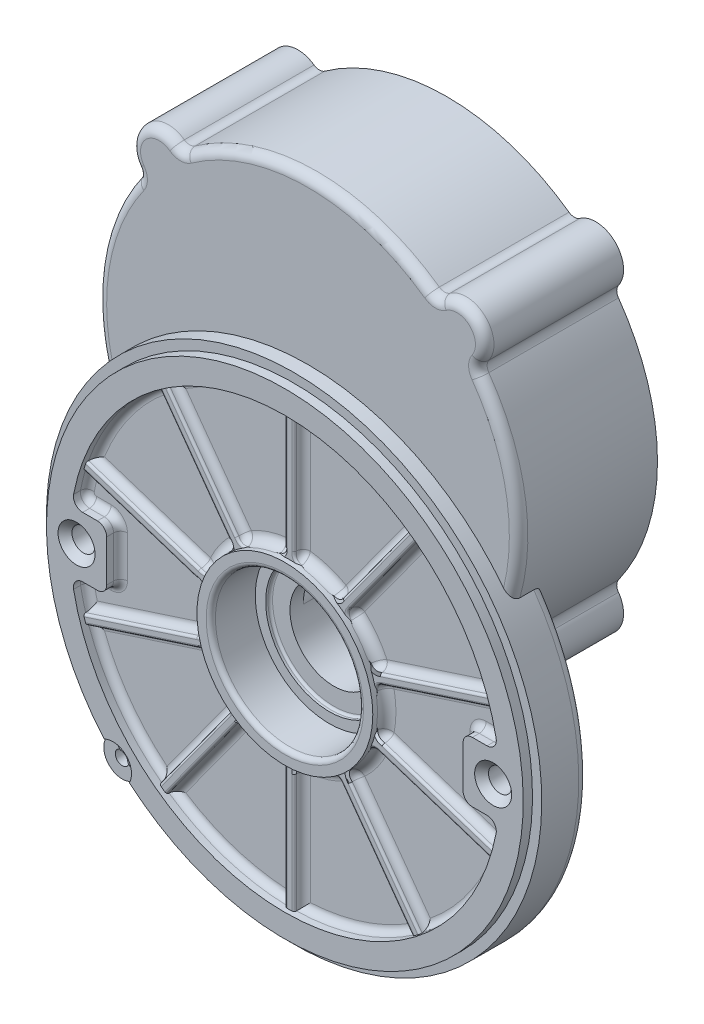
SolidWorks part; units mm, degrees
ref_plane "Plan de face" through (0, 0, 0) normal (0, 0, 1) x (1, 0, 0)
ref_plane "Plan de dessus" through (0, 0, 0) normal (0, 1, 0) x (1, 0, 0)
ref_plane "Plan de droite" through (0, 0, 0) normal (1, 0, 0) x (0, 0, -1)
sketch "Esquisse1" plane through (0, 0, 0) normal (0, 0, 1) x (1, 0, 0)
  line L0 (0, 0) -> (0, -63.3362) construction
  line L1 (0, 0) -> (-45.1115, -45.1115) construction
  arc A0 (-34.9665, -40.4919) -> (-40.4919, -34.9665) centre (0, 0) ccw
  arc A1 (-40.4919, -34.9665) -> (-34.9665, -40.4919) centre (-37.1231, -37.1231) ccw
  dimension "D1" = 107
  dimension "D3" = 8
  dimension "D2" = 45
  dimension "D4" = 52.5
extrude "Extrusion1" add sketch "Esquisse1" along normal blind 12
sketch "Esquisse2" plane through (0, 0, 12) normal (0, 0, 1) x (1, 0, 0)
  circle A0 centre (0, 0) radius 51.5
  dimension "D1" = 103
extrude "Enlèv. mat.-Extru.1" cut sketch "Esquisse2" against normal blind 2 flip side to cut
sketch "Esquisse3" plane through (0, 0, 12) normal (0, 0, 1) x (1, 0, 0)
  circle A0 centre (-37.1231, -37.1231) radius 4
  dimension "D1" = 8
extrude "Enlèv. mat.-Extru.2" cut sketch "Esquisse3" against normal blind 1.7
sketch "Esquisse4" plane through (0, 0, 12) normal (0, 0, 1) x (1, 0, 0)
  circle A0 centre (0, 0) radius 16
  dimension "D1" = 32
extrude "Enlèv. mat.-Extru.3" cut sketch "Esquisse4" against normal blind 9.6
sketch "Esquisse5" plane through (0, 0, 2.4) normal (0, 0, 1) x (1, 0, 0)
  circle A0 centre (0, 0) radius 13.75
  dimension "D1" = 27.5
extrude "Enlèv. mat.-Extru.4" cut sketch "Esquisse5" against normal blind 1
fillet "Congé1" radius 0.5 1 edges at (13.75, 0, 1.4)
sketch "Esquisse7" plane through (0, 0, 12) normal (0, 0, 1) x (1, 0, 0)
  line L0 (0, 0) -> (-60.7876, 0) construction
  line L1 (-43.6807, 6.5) -> (-40.5, 6.5)
  line L2 (-38.5, 4.5) -> (-38.5, -4.5)
  line L3 (-40.5, -6.5) -> (-43.6807, -6.5)
  line L4 (0, 49.5301) -> (0, -57.4671) construction
  line L5 (40.5, -6.5) -> (43.6807, -6.5)
  line L6 (38.5, 4.5) -> (38.5, -4.5)
  line L7 (43.6807, 6.5) -> (40.5, 6.5)
  arc A0 (-45.6438, -8.882) -> (45.6438, -8.882) centre (0, 0) ccw
  circle A1 centre (0, 0) radius 19
  arc A2 (-43.6807, 6.5) -> (-45.6438, 8.882) centre (-43.6807, 8.5) cw
  arc A3 (-45.6438, -8.882) -> (-43.6807, -6.5) centre (-43.6807, -8.5) cw
  arc A4 (-38.5, 4.5) -> (-40.5, 6.5) centre (-40.5, 4.5) ccw
  arc A5 (-40.5, -6.5) -> (-38.5, -4.5) centre (-40.5, -4.5) ccw
  arc A6 (45.6438, 8.882) -> (-45.6438, 8.882) centre (0, 0) ccw
  arc A7 (40.5, -6.5) -> (38.5, -4.5) centre (40.5, -4.5) cw
  arc A8 (38.5, 4.5) -> (40.5, 6.5) centre (40.5, 4.5) cw
  arc A9 (45.6438, -8.882) -> (43.6807, -6.5) centre (43.6807, -8.5) ccw
  arc A10 (43.6807, 6.5) -> (45.6438, 8.882) centre (43.6807, 8.5) ccw
  point P14 (-38.5, 6.5)
  point P17 (-38.5, -6.5)
  dimension "D1" = 93
  dimension "D2" = 38
  dimension "D5" = 2
  dimension "D3" = 13
  dimension "D4" = 38.5
extrude "Enlèv. mat.-Extru.6" cut sketch "Esquisse7" against normal blind 3
ref_plane "Plan1" through (0, 0, 11) normal (0, 0, 1) x (1, 0, 0)
fillet "Congé3" radius 2 1 edges at (19, 0, 9)
sketch "Esquisse8" plane through (0, 0, 11) normal (0, 0, 1) x (1, 0, 0)
  line L0 (0, 46.5) -> (0, 19)
  line L1 (27.332, 37.6193) -> (11.1679, 15.3713)
  line L2 (44.2241, 14.3693) -> (18.0701, 5.8713)
  line L3 (44.2241, -14.3693) -> (18.0701, -5.8713)
  line L4 (27.332, -37.6193) -> (11.1679, -15.3713)
  line L5 (0, -46.5) -> (0, -19)
  line L6 (-27.332, -37.6193) -> (-11.1679, -15.3713)
  line L7 (-44.2241, -14.3693) -> (-18.0701, -5.8713)
  line L8 (-44.2241, 14.3693) -> (-18.0701, 5.8713)
  line L9 (-27.332, 37.6193) -> (-11.1679, 15.3713)
  arc A0 (45.6438, 8.882) -> (-45.6438, 8.882) centre (0, 0) ccw construction
  arc A1 (45.6438, 8.882) -> (-45.6438, 8.882) centre (0, 0) ccw construction
  circle A2 centre (0, 0) radius 19 construction
rib "Nervure1" sketch "Esquisse8" sketch "Esquisse8" thickness 2 extrusion direction normal to sketch draft on no parameters "D1"=2
fillet "Congé4" radius 1.5 66 edges at (-31.7727, 11.375, 9) (-18.1572, 6.9511, 9.7456) (37.6193, -27.332, 9) (20.6366, -26.7026, 9) (12.3019, -15.2308, 9.5932) (19.0186, -27.8781, 9) (10.6838, -16.4063, 9.5932) (-14.3693, 44.2241, 9) (-1, 33.7327, 9) (1, 33.7327, 9) (10.6838, 16.4063, 9.5932) (12.3019, 15.2308, 9.5932) (14.3693, 44.2241, 9) (19.0186, 27.8781, 9) (20.6366, 26.7026, 9) (18.1572, 6.9511, 9.7456) (18.7084, 5.0273, 9.8381) (37.6193, 27.332, 9) (31.7727, 11.375, 9) (32.3907, 9.4729, 9) (18.7084, -5.0273, 9.8381) (18.1572, -6.9511, 9.7456) (45.1403, -11.1625, 9) (32.3907, -9.4729, 9) (31.7727, -11.375, 9) (-45.224, 7.228, 9) (45.1403, 11.1625, 9) (-12.3019, 15.2308, 9.5932) (-10.6838, 16.4063, 9.5932) (45.224, 7.228, 9) (42.0903, 6.5, 9) (39.0858, 5.9142, 9) (-37.6193, 27.332, 9) (38.5, 0, 9) (39.0858, -5.9142, 9) (42.0903, -6.5, 9) (45.224, -7.228, 9) (-45.1403, -11.1625, 9) (-45.224, -7.228, 9) (-42.0903, -6.5, 9) (-39.0858, -5.9142, 9) (-20.6366, 26.7026, 9) (-38.5, 0, 9) (-39.0858, 5.9142, 9) (-19.0186, 27.8781, 9) (-42.0903, 6.5, 9) (14.3693, -44.2241, 9) (1, -33.7327, 9) (1, -22.253, 12.5405) (-1, -33.7327, 9) (-1, -22.253, 12.5405) (-14.3693, -44.2241, 9) (-19.0186, -27.8781, 9) (-10.6838, -16.4063, 9.5932) (-20.6366, -26.7026, 9) (-12.3019, -15.2308, 9.5932) (-37.6193, -27.332, 9) (-31.7727, -11.375, 9) (-18.1572, -6.9511, 9.7456) (-32.3907, -9.4729, 9) (-18.7084, -5.0273, 9.8381) (-45.1403, 11.1625, 9) (-1, 22.3559, 12.4493) (1, 22.3559, 12.4493) (-32.3907, 9.4729, 9) (-18.7084, 5.0273, 9.8381)
hole_wizard "Trou taraudé M61" positions "Esquisse11" profile "Esquisse10" tap size "M6" standard "ISO"
sketch "Esquisse11" plane through (0, 0, 12) normal (0, 0, 1) x (1, 0, 0)
  line L0 (50.217, 0) -> (-50.217, 0) construction
  line L1 (0, 0) -> (0, 22.361) construction
  point P0 (-45, 0)
  point P1 (45, 0)
  dimension "D1" = 90
sketch "Esquisse10" plane through (-45, 0, 12) normal (1, 0, 0) x (0, -1, 0)
  line L0 (0, 0) -> (0, 12)
  line L1 (0, 12) -> (2.5, 12)
  line L2 (2.5, 12) -> (2.5, 0)
  line L5 (2.5, 0) -> (0, 0)
  line L11 (0, -6.35) -> (0, 107.95) construction
  dimension "Diamètre du trou pour taraudage jusqu'au prochain" = 5
  dimension "Profondeur du trou pour taraudage jusqu'au prochain" = 12
chamfer "Chanfrein1" distance 1.5 angle 45 2 edges at (47.5, 0, 12) (-42.5, 0, 12)
hole_wizard "Diamètre du perçage Ø3.0 (3)1" positions "Esquisse13" profile "Esquisse12" hole size "Ø3.0" standard "ISO"
sketch "Esquisse13" plane through (0, 0, 10.3) normal (0, 0, 1) x (1, 0, 0)
  arc A0 (-40.4919, -34.9665) -> (-34.9665, -40.4919) centre (-37.1231, -37.1231) ccw construction
  point P0 (-37.1231, -37.1231)
sketch "Esquisse12" plane through (-37.1231, -37.1231, 10.3) normal (1, 0, 0) x (0, -1, 0)
  line L0 (0, 0) -> (0, 5.9013)
  line L1 (0, 5.9013) -> (1.5, 5)
  line L2 (1.5, 5) -> (1.5, 0)
  line L5 (1.5, 0) -> (0, 0)
  line L10 (0, 5.9013) -> (-1.5, 5) construction
  line L11 (0, -6.35) -> (0, 107.95) construction
  dimension "Diamètre du perçage" = 3
  dimension "Profondeur du perçage" = 5
  dimension "Angle de pointe" = 118
fillet "Congé5" radius 2 1 edges at (37.8302, 37.8302, 0)
fillet "Congé6" radius 1 1 edges at (-39.9515, -39.9515, 0)
fillet "Congé7" radius 0.5 6 edges at (-34.9665, -40.4919, 6) (-40.4919, -34.9665, 6) (-40.4298, -34.8724, 1.3504) (-34.8827, -40.4368, 1.3864) (-34.4775, -39.8418, 0.3914) (-39.8418, -34.4775, 0.3914)
sketch "Esquisse14" plane through (0, 0, 0) normal (0, 0, -1) x (-1, 0, 0)
  circle A0 centre (0, 0) radius 9.5
  circle A1 centre (0, 0) radius 19
  dimension "D1" = 19
  dimension "D2" = 38
extrude "Extrusion2" add sketch "Esquisse14" along normal blind 1.5
ref_plane "Plan2" through (0, 0, 7) normal (0, 0, 1) x (1, 0, 0)
sketch "Esquisse15" plane through (0, 0, 7) normal (0, 0, 1) x (1, 0, 0)
  line L0 (0, 0) -> (0, 48.6224) construction
  line L1 (0, 43.125) -> (-42.5537, 85.6787) construction
  arc A0 (14.2416, -0.0887) -> (27.6602, 6.998) centre (0, 43.125) ccw
  arc A1 (-12.8853, -1.7231) -> (12.8853, -1.7231) centre (0, 0) ccw
  arc A2 (-9.4936, -0.3493) -> (9.4936, -0.3493) centre (0, 0) ccw
  arc A3 (12.9152, 4.2123) -> (-12.9152, 4.2123) centre (0, 43.125) ccw
  arc A4 (-12.8853, -1.7231) -> (-14.2416, -0.0887) centre (-14.8676, -1.9882) ccw
  arc A5 (12.8853, -1.7231) -> (14.2416, -0.0887) centre (14.8676, -1.9882) cw
  arc A6 (-9.4936, -0.3493) -> (-12.9152, 4.2123) centre (-14.4902, -0.5332) ccw
  arc A7 (12.9152, 4.2123) -> (9.4936, -0.3493) centre (14.4902, -0.5332) ccw
  arc A8 (36.127, 70.7852) -> (27.6602, 79.252) centre (32.1734, 75.2984) ccw
  arc A9 (-27.6602, 79.252) -> (-36.127, 70.7852) centre (-32.1734, 75.2984) ccw
  arc A10 (-36.127, 70.7852) -> (-36.127, 15.4648) centre (0, 43.125) ccw
  arc A11 (27.6602, 6.998) -> (36.127, 15.4648) centre (32.1734, 10.9516) ccw
  arc A12 (-36.127, 15.4648) -> (-27.6602, 6.998) centre (-32.1734, 10.9516) ccw
  arc A13 (27.6602, 79.252) -> (-27.6602, 79.252) centre (0, 43.125) ccw
  arc A14 (36.127, 15.4648) -> (36.127, 70.7852) centre (0, 43.125) ccw
  arc A15 (-27.6602, 6.998) -> (-14.2416, -0.0887) centre (0, 43.125) ccw
  dimension "D1" = 91
  dimension "D3" = 26
  dimension "D4" = 19
  dimension "D5" = 82
  dimension "D6" = 2
  dimension "D7" = 5
  dimension "D9" = 45.5
  dimension "D10" = 6
  dimension "D2" = 43.125
  dimension "D8" = 45
extrude "Extrusion3" add sketch "Esquisse15" against normal blind 30
sketch "Esquisse6" plane through (0, 0, 1.4) normal (0, 0, 1) x (1, 0, 0)
  circle A0 centre (0, 0) radius 9.5
  dimension "D1" = 19
extrude "Enlèv. mat.-Extru.5" cut sketch "Esquisse6" against normal through all
sketch "Esquisse16" plane through (0, 0, 0) normal (1, 0, 0) x (0, 0, -1)
  line L0 (-12, 16) -> (-2.4, 16)
  line L1 (-12, 51.5) -> (-12, -51.5) construction
  line L2 (-2.4, 16) -> (-2.4, 5.0408) construction
  line L3 (-2.4, 16) -> (-2.4, 13.75)
  line L4 (-2.4, 13.75) -> (-1.9, 13.75)
  line L5 (-1.4, 13.25) -> (-1.4, 9.5)
  line L6 (-1.4, 9.5) -> (1.5, 9.5)
  line L7 (1.5, 9.5) -> (1.5, 0)
  line L8 (1.5, -19) -> (1.5, 1.7451) construction
  line L9 (1.5, 0) -> (-12, 0)
  line L10 (-12, 0) -> (-12, 16)
  line L11 (-1.4, 13.25) -> (-1.4, 4.0962) construction
  line L12 (-2.4, 16) -> (-12, 16) construction
  line L13 (-12, 0) -> (-16.5173, 0) construction
  arc A0 (-1.9, 13.75) -> (-1.4, 13.25) centre (-1.9, 13.25) cw
  dimension "D1" = 0.5
revolve "Enlèvement de matière-Révolution1" cut sketch "Esquisse16" angle 360 about L13
fillet "Congé2" radius 1 1 edges at (16, 0, 12)
sketch "Esquisse18" plane through (0, 0, 7) normal (0, 0, 1) x (1, 0, 0)
  arc A0 (43.7834, 30.7451) -> (36.127, 70.7852) centre (0, 43.125) ccw construction
  arc A1 (36.127, 70.7852) -> (27.6602, 79.252) centre (32.1734, 75.2984) ccw construction
  arc A2 (27.6602, 79.252) -> (-27.6602, 79.252) centre (0, 43.125) ccw construction
  arc A3 (-27.6602, 79.252) -> (-36.127, 70.7852) centre (-32.1734, 75.2984) ccw construction
  arc A4 (-36.127, 70.7852) -> (-43.7834, 30.7451) centre (0, 43.125) ccw construction
  arc A5 (43.7834, 30.7451) -> (36.127, 70.7852) centre (0, 43.125) ccw
  arc A6 (36.127, 70.7852) -> (27.6602, 79.252) centre (32.1734, 75.2984) ccw
  arc A7 (27.6602, 79.252) -> (-27.6602, 79.252) centre (0, 43.125) ccw
  arc A8 (-27.6602, 79.252) -> (-36.127, 70.7852) centre (-32.1734, 75.2984) ccw
  arc A9 (-36.127, 70.7852) -> (-43.7834, 30.7451) centre (0, 43.125) ccw
  arc A10 (-34.6981, -40.7221) -> (-40.7221, -34.6981) centre (0, 0) ccw construction
  arc A11 (43.7834, 30.7451) -> (-43.7834, 30.7451) centre (0, 0) ccw
extrude "Extrusion5" add sketch "Esquisse18" against normal blind 4
sketch "Esquisse19" plane through (0, 0, 3) normal (0, 0, -1) x (-1, 0, 0)
  arc A0 (40.2382, 35.2582) -> (-40.2382, 35.2582) centre (0, 0) ccw construction
  arc A1 (40.2382, 35.2582) -> (-40.2382, 35.2582) centre (0, 0) ccw
  arc A2 (17.9398, 6.2582) -> (39.6847, 32.8234) centre (0, 43.125) ccw construction
  arc A3 (17.9398, 6.2582) -> (39.6847, 32.8234) centre (0, 43.125) ccw
  arc A4 (39.6847, 32.8234) -> (40.2382, 35.2582) centre (0, 43.125) ccw construction
  arc A5 (39.6847, 32.8234) -> (40.2382, 35.2582) centre (0, 43.125) ccw
  arc A6 (-39.6847, 32.8234) -> (-17.9398, 6.2582) centre (0, 43.125) ccw construction
  arc A7 (-39.6847, 32.8234) -> (-17.9398, 6.2582) centre (0, 43.125) ccw
  arc A8 (-40.2382, 35.2582) -> (-39.6847, 32.8234) centre (0, 43.125) ccw construction
  arc A9 (-40.2382, 35.2582) -> (-39.6847, 32.8234) centre (0, 43.125) ccw
  arc A10 (17.9398, 6.2582) -> (-17.9398, 6.2582) centre (0, 0) ccw construction
  arc A11 (17.9398, 6.2582) -> (-17.9398, 6.2582) centre (0, 0) ccw
extrude "Enlèv. mat.-Extru.7" cut sketch "Esquisse19" along normal through all
sketch "Esquisse20" plane through (0, 0, -23) normal (0, 0, -1) x (-1, 0, 0)
  circle A0 centre (0, 43.125) radius 41.5
  dimension "D1" = 83
extrude "Enlèv. mat.-Extru.8" cut sketch "Esquisse20" against normal blind 3
ref_plane "Plan3" through (0, 0, -3.5) normal (0, 0, -1) x (-1, 0, 0)
sketch "Esquisse21" plane through (0, 0, -3.5) normal (0, 0, -1) x (-1, 0, 0)
  circle A0 centre (0, 43.125) radius 16
  dimension "D1" = 32
extrude "Extrusion6" add sketch "Esquisse21" against normal up to surface (10.5 mm away)
sketch "Esquisse22" plane through (0, 0, -3.5) normal (0, 0, -1) x (-1, 0, 0)
  circle A0 centre (0, 43.125) radius 13
  dimension "D1" = 26
extrude "Enlèv. mat.-Extru.9" cut sketch "Esquisse22" against normal blind 7
sketch "Esquisse23" plane through (0, 0, 3.5) normal (0, 0, -1) x (-1, 0, 0)
  circle A0 centre (0, 43.125) radius 11
  dimension "D1" = 22
extrude "Enlèv. mat.-Extru.10" cut sketch "Esquisse23" against normal blind 1.5
fillet "Congé8" radius 1 1 edges at (-13, 43.125, -3.5)
ref_plane "Plan4" through (0, 0, 0) normal (0, 0, -1) x (-1, 0, 0)
sketch "Esquisse24" plane through (0, 0, 0) normal (0, 0, -1) x (-1, 0, 0)
  line L0 (0, 84.6264) -> (0, 59.125)
  line L1 (24.1718, 76.8589) -> (9.1824, 56.2278)
  line L2 (39.1615, 56.367) -> (14.9082, 48.4867)
  line L3 (39.2436, 30.978) -> (14.9903, 38.8584)
  line L4 (24.3868, 10.3896) -> (9.3974, 31.0207)
  line L5 (0, 19) -> (0, 27.125)
  line L6 (-23.906, 10.2334) -> (-8.9166, 30.8645)
  line L7 (-38.8957, 30.7253) -> (-14.6424, 38.6057)
  line L8 (-38.9778, 56.1143) -> (-14.7245, 48.2339)
  line L9 (-24.121, 76.7027) -> (-9.1316, 56.0716)
  line L10 (0.2658, 2.4659) -> (0.2658, 27.9673)
  circle A2 centre (0, 43.125) radius 16 construction
  arc A3 (11.0923, 3.1349) -> (-11.0923, 3.1349) centre (0, 43.125) ccw construction
  arc A4 (17.9398, 6.2582) -> (-17.9398, 6.2582) centre (0, 0) ccw construction
  arc A5 (17.9398, 6.2582) -> (-17.9398, 6.2582) centre (0, 0) ccw construction
  circle A6 centre (0, 43.125) radius 16 construction
  point P11 (0, 43.125)
rib "Nervure2" sketch "Esquisse24" sketch "Esquisse24" thickness 2 extrusion direction normal to sketch draft on no parameters "D1"=2
fillet "Congé9" radius 1.5 42 edges at (-15.9911, 43.6596, 3) (-27.2567, 51.4475, 3) (-40.9965, 43.6586, 3) (-27.5403, 35.8321, 3) (-12.7151, 52.8372, 3) (-17.3333, 65.7453, 3) (-32.9433, 67.5328, 3) (-26.5979, 53.3363, 3) (-13.2499, 34.1562, 3) (-26.9699, 33.9146, 3) (-33.4792, 19.4577, 3) (-17.9273, 20.9816, 3) (11.4061, 15.1954, 3) (-11.4061, 15.1954, 3) (1, 23.065, 3) (-1, 23.065, 3) (-5.176, 27.9853, 3) (-16.3343, 19.7716, 3) (-20.8807, 7.8405, 3) (4.9477, 27.9092, 3) (20.6734, 7.7186, 3) (15.9361, 19.5018, 3) (13.0127, 33.8154, 3) (17.5537, 20.6779, 3) (33.2383, 19.1205, 3) (26.8538, 33.5865, 3) (15.9978, 43.3931, 3) (27.453, 35.4947, 3) (40.9991, 43.3927, 3) (27.3088, 51.2713, 3) (17.3734, 65.7142, 3) (12.7861, 52.7435, 3) (26.6653, 53.1651, 3) (33.0129, 67.4385, 3) (1, 71.6033, 3) (4.8382, 58.3759, 3) (15.744, 66.8741, 3) (12.564, 82.1525, 3) (-4.814, 58.3836, 3) (-1, 71.6033, 3) (-12.5398, 82.1603, 3) (-15.7013, 66.9017, 3)
fillet "Congé10" radius 2 8 edges at (27.6602, 79.252, -8) (-27.6602, 79.252, -8) (-36.127, 70.7852, -8) (-36.127, 15.4648, -11.5) (-27.6602, 6.998, -11.5) (27.6602, 6.998, -11.5) (36.127, 15.4648, -11.5) (36.127, 70.7852, -8)
fillet "Congé11" radius 2 9 edges at (-44.8324, 50.8907, 7) (-36.6982, 70.6679, 7) (-36.416, 79.541, 7) (-27.5429, 79.8232, 7) (0, 88.625, 7) (27.5429, 79.8232, 7) (36.416, 79.541, 7) (36.6982, 70.6679, 7) (44.8324, 50.8907, 7)
hole_wizard "Trou taraudé M62" positions "Esquisse26" profile "Esquisse25" tap size "M6" standard "ISO"
sketch "Esquisse26" plane through (0, 0, -23) normal (0, 0, -1) x (-1, 0, 0)
  arc A0 (-37.067, 14.4233) -> (-28.7017, 6.058) centre (-32.1734, 10.9516) ccw construction
  point P0 (-32.1734, 10.9516)
  point P1 (32.1734, 10.9516)
  point P4 (32.1734, 75.2984)
  point P7 (-32.1734, 75.2984)
sketch "Esquisse25" plane through (32.1734, 10.9516, -23) normal (1, 0, 0) x (0, 1, 0)
  line L0 (0, 0) -> (0, 18.5022)
  line L1 (0, 18.5022) -> (2.5, 17)
  line L2 (2.5, 17) -> (2.5, 0)
  line L5 (2.5, 0) -> (0, 0)
  line L10 (0, 18.5022) -> (-2.5, 17) construction
  line L11 (0, -6.35) -> (0, 107.95) construction
  dimension "Diamètre du trou pour taraudage" = 5
  dimension "Profondeur du trou pour taraudage" = 17
  dimension "Angle de pointe" = 118
fillet "Congé12" radius 1 1 edges at (0, 19, -1.5)
sketch "Esquisse27" plane through (0, 0, 0) normal (0, 0, -1) x (-1, 0, 0)
  arc A0 (-41.1541, 23.719) -> (-46.5423, 9.4903) centre (0, 0) ccw
  arc A1 (-44.0685, -5.9273) -> (-44.0685, 5.9273) centre (-45, 0) ccw
  arc A2 (44.0685, 5.9273) -> (44.0685, -5.9273) centre (45, 0) ccw
  arc A3 (46.5423, 9.4903) -> (41.1541, 23.719) centre (0, 0) ccw
  arc A4 (-46.5423, -9.4903) -> (46.5423, -9.4903) centre (0, 0) ccw
  arc A5 (-46.5423, 9.4903) -> (-44.0685, 5.9273) centre (-43.6028, 8.8909) ccw
  arc A6 (-46.5423, -9.4903) -> (-44.0685, -5.9273) centre (-43.6028, -8.8909) cw
  arc A7 (46.5423, 9.4903) -> (44.0685, 5.9273) centre (43.6028, 8.8909) cw
  arc A8 (46.5423, -9.4903) -> (44.0685, -5.9273) centre (43.6028, -8.8909) ccw
  arc A15 (37.0688, 16.7403) -> (43.0206, 28.3103) centre (0, 43.125) ccw
  arc A16 (37.0688, 16.7403) -> (37.067, 14.4233) centre (38.6982, 15.5805) ccw
  arc A17 (28.7017, 6.058) -> (37.067, 14.4233) centre (32.1734, 10.9516) ccw
  arc A18 (28.7017, 6.058) -> (26.3847, 6.0562) centre (27.5445, 4.4268) ccw
  arc A19 (18.9197, 1.7451) -> (26.3847, 6.0562) centre (0, 43.125) ccw
  arc A20 (-18.9197, 1.7451) -> (18.9197, 1.7451) centre (0, 0) ccw
  arc A21 (-26.3847, 6.0562) -> (-18.9197, 1.7451) centre (0, 43.125) ccw
  arc A22 (-26.3847, 6.0562) -> (-28.7017, 6.058) centre (-27.5445, 4.4268) ccw
  arc A23 (-37.067, 14.4233) -> (-28.7017, 6.058) centre (-32.1734, 10.9516) ccw
  arc A24 (-37.067, 14.4233) -> (-37.0688, 16.7403) centre (-38.6982, 15.5805) ccw
  arc A25 (-43.0206, 28.3103) -> (-37.0688, 16.7403) centre (0, 43.125) ccw
  arc A26 (-43.0206, 28.3103) -> (34.382, -38.3423) centre (0, 0) ccw
  arc A27 (34.382, -38.3423) -> (38.3423, -34.382) centre (37.1231, -37.1231) ccw
  arc A28 (38.3423, -34.382) -> (43.0206, 28.3103) centre (0, 0) ccw
  arc A29 (37.0688, 16.7403) -> (41.1541, 23.719) centre (0, 43.125) ccw
  arc A30 (37.0688, 16.7403) -> (37.067, 14.4233) centre (38.6982, 15.5805) ccw
  arc A31 (28.7017, 6.058) -> (37.067, 14.4233) centre (32.1734, 10.9516) ccw
  arc A32 (28.7017, 6.058) -> (26.3847, 6.0562) centre (27.5445, 4.4268) ccw
  arc A33 (18.9197, 1.7451) -> (26.3847, 6.0562) centre (0, 43.125) ccw
  arc A34 (-18.9197, 1.7451) -> (18.9197, 1.7451) centre (0, 0) ccw
  arc A35 (-26.3847, 6.0562) -> (-18.9197, 1.7451) centre (0, 43.125) ccw
  arc A36 (-26.3847, 6.0562) -> (-28.7017, 6.058) centre (-27.5445, 4.4268) ccw
  arc A37 (-37.067, 14.4233) -> (-28.7017, 6.058) centre (-32.1734, 10.9516) ccw
  arc A38 (-37.067, 14.4233) -> (-37.0688, 16.7403) centre (-38.6982, 15.5805) ccw
  arc A39 (-41.1541, 23.719) -> (-37.0688, 16.7403) centre (0, 43.125) ccw
  dimension "D1" = 95
  dimension "D3" = 12
  dimension "D4" = 3
  dimension "D2" = 0
extrude "Enlèv. mat.-Extru.11" cut sketch "Esquisse27" against normal blind 5
ref_plane "Plan5" through (0, 0, 1) normal (0, 0, -1) x (-1, 0, 0)
sketch "Esquisse28" plane through (0, 0, 1) normal (0, 0, -1) x (-1, 0, 0)
  line L0 (0, -19) -> (0, -51.5)
  line L1 (-19, 0) -> (-39, 0)
  line L2 (19, 0) -> (39, 0)
  line L3 (9.5, -16.4545) -> (23.75, -41.1362)
  line L4 (16.4545, -9.5) -> (41.1362, -23.75)
  line L5 (-9.5, -16.4545) -> (-23.75, -41.1362)
  line L6 (-16.4545, -9.5) -> (-41.1362, -23.75)
  arc A0 (-18.9197, 1.7451) -> (18.9197, 1.7451) centre (0, 0) ccw construction
  arc A1 (-43.0206, 28.3103) -> (34.382, -38.3423) centre (0, 0) ccw construction
  arc A2 (-18.9197, 1.7451) -> (18.9197, 1.7451) centre (0, 0) ccw construction
  arc A3 (-44.0685, -5.9273) -> (-44.0685, 5.9273) centre (-45, 0) ccw construction
  arc A4 (44.0685, 5.9273) -> (44.0685, -5.9273) centre (45, 0) ccw construction
  arc A5 (-46.5423, -9.4903) -> (46.5423, -9.4903) centre (0, 0) ccw construction
  dimension "D1" = 30
  dimension "D2" = 30
  dimension "D3" = 30
  dimension "D4" = 30
rib "Nervure3" sketch "Esquisse28" sketch "Esquisse28" thickness 2 extrusion direction normal to sketch draft on no parameters "D1"=2
fillet "Congé14" radius 1.5 28 edges at (-29.0288, -1, 5) (-40.782, -4.2671, 5) (-46.0671, -7.1799, 5) (-44.59, -16.37, 5) (-29.2794, -15.7498, 5) (-18.3526, -4.9176, 5) (-33.5876, -33.5876, 5) (-17.4818, -28.2794, 5) (-13.435, -13.435, 5) (-28.2794, -17.4818, 5) (-12.2939, -45.8815, 5) (-1, -33.2316, 5) (-4.9176, -18.3526, 5) (-15.7498, -29.2794, 5) (1, -33.2316, 5) (12.2939, -45.8815, 5) (15.7498, -29.2794, 5) (4.9176, -18.3526, 5) (17.4818, -28.2794, 5) (33.5876, -33.5876, 5) (28.2794, -17.4818, 5) (13.435, -13.435, 5) (44.59, -16.37, 5) (46.0671, -7.1799, 5) (40.782, -4.2671, 5) (29.0288, -1, 5) (18.3526, -4.9176, 5) (29.2794, -15.7498, 5)
sketch "Esquisse30" plane through (0, 0, 1) normal (0, 0, -1) x (-1, 0, 0)
  line L0 (0, 0) -> (0, -47.5) construction
  arc A0 (-1, -47.4895) -> (1, -47.4895) centre (0, 0) ccw construction
  circle A1 centre (0, -40) radius 3
  dimension "D1" = 6
  dimension "D2" = 40
extrude "Enlèv. mat.-Extru.12" cut sketch "Esquisse30" against normal up to surface (4 mm away)
sketch "Esquisse31" plane through (0, 0, 5) normal (0, 0, -1) x (-1, 0, 0)
  circle A0 centre (0, -40) radius 3
  dimension "D1" = 6
extrude "Extrusion7" add sketch "Esquisse31" along normal blind 3
sketch "Esquisse32" plane through (0, 0, 5) normal (0, 0, -1) x (-1, 0, 0)
  line L1 (-39.0839, 1) -> (-18.9737, 1)
  line L2 (-39.0839, 1) -> (-18.9737, 1)
  line L3 (18.9737, 1) -> (39.0839, 1)
  line L4 (18.9737, 1) -> (39.0839, 1)
  arc A9 (-41.1541, 23.719) -> (-37.0688, 16.7403) centre (0, 43.125) ccw
  arc A10 (-41.1541, 23.719) -> (-46.5423, 9.4903) centre (0, 0) ccw
  arc A11 (-46.5423, 9.4903) -> (-44.0685, 5.9273) centre (-43.6028, 8.8909) ccw
  arc A12 (-39.0839, 1) -> (-44.0685, 5.9273) centre (-45, 0) ccw
  arc A13 (-18.9197, 1.7451) -> (-18.9737, 1) centre (0, 0) ccw
  arc A14 (-26.3847, 6.0562) -> (-18.9197, 1.7451) centre (0, 43.125) ccw
  arc A15 (-26.3847, 6.0562) -> (-28.7017, 6.058) centre (-27.5445, 4.4268) ccw
  arc A16 (-37.067, 14.4233) -> (-28.7017, 6.058) centre (-32.1734, 10.9516) ccw
  arc A17 (-37.067, 14.4233) -> (-37.0688, 16.7403) centre (-38.6982, 15.5805) ccw
  arc A18 (-41.1541, 23.719) -> (-37.0688, 16.7403) centre (0, 43.125) ccw
  arc A19 (-41.1541, 23.719) -> (-46.5423, 9.4903) centre (0, 0) ccw
  arc A20 (-46.5423, 9.4903) -> (-44.0685, 5.9273) centre (-43.6028, 8.8909) ccw
  arc A21 (-39.0839, 1) -> (-44.0685, 5.9273) centre (-45, 0) ccw
  arc A22 (-18.9197, 1.7451) -> (-18.9737, 1) centre (0, 0) ccw
  arc A23 (-26.3847, 6.0562) -> (-18.9197, 1.7451) centre (0, 43.125) ccw
  arc A24 (-26.3847, 6.0562) -> (-28.7017, 6.058) centre (-27.5445, 4.4268) ccw
  arc A25 (-37.067, 14.4233) -> (-28.7017, 6.058) centre (-32.1734, 10.9516) ccw
  arc A26 (-37.067, 14.4233) -> (-37.0688, 16.7403) centre (-38.6982, 15.5805) ccw
  arc A27 (37.0688, 16.7403) -> (41.1541, 23.719) centre (0, 43.125) ccw
  arc A28 (37.0688, 16.7403) -> (37.067, 14.4233) centre (38.6982, 15.5805) ccw
  arc A29 (28.7017, 6.058) -> (37.067, 14.4233) centre (32.1734, 10.9516) ccw
  arc A30 (28.7017, 6.058) -> (26.3847, 6.0562) centre (27.5445, 4.4268) ccw
  arc A31 (18.9197, 1.7451) -> (26.3847, 6.0562) centre (0, 43.125) ccw
  arc A32 (18.9737, 1) -> (18.9197, 1.7451) centre (0, 0) ccw
  arc A33 (44.0685, 5.9273) -> (39.0839, 1) centre (45, 0) ccw
  arc A34 (44.0685, 5.9273) -> (46.5423, 9.4903) centre (43.6028, 8.8909) ccw
  arc A35 (46.5423, 9.4903) -> (41.1541, 23.719) centre (0, 0) ccw
  arc A36 (37.0688, 16.7403) -> (41.1541, 23.719) centre (0, 43.125) ccw
  arc A37 (37.0688, 16.7403) -> (37.067, 14.4233) centre (38.6982, 15.5805) ccw
  arc A38 (28.7017, 6.058) -> (37.067, 14.4233) centre (32.1734, 10.9516) ccw
  arc A39 (28.7017, 6.058) -> (26.3847, 6.0562) centre (27.5445, 4.4268) ccw
  arc A40 (18.9197, 1.7451) -> (26.3847, 6.0562) centre (0, 43.125) ccw
  arc A41 (18.9737, 1) -> (18.9197, 1.7451) centre (0, 0) ccw
  arc A42 (44.0685, 5.9273) -> (39.0839, 1) centre (45, 0) ccw
  arc A43 (44.0685, 5.9273) -> (46.5423, 9.4903) centre (43.6028, 8.8909) ccw
  arc A44 (46.5423, 9.4903) -> (41.1541, 23.719) centre (0, 0) ccw
  dimension "D1" = 0
  dimension "D2" = 0
extrude "Extrusion8" add sketch "Esquisse32" along normal blind 2
fillet "Congé17" radius 1 18 edges at (39.2668, 20.1387, 3) (36.6982, 15.5821, 3) (36.416, 6.709, 3) (27.5429, 6.4268, 3) (22.7545, 3.7235, 3) (40.782, 4.2671, 3) (46.0671, 7.1799, 3) (44.4216, 16.8218, 3) (-40.782, 4.2671, 3) (-46.0671, 7.1799, 3) (-39.2668, 20.1387, 3) (-36.6982, 15.5821, 3) (-36.416, 6.709, 3) (-27.5429, 6.4268, 3) (-29.0288, 1, 3) (-44.4216, 16.8218, 3) (-22.7545, 3.7235, 3) (29.0288, 1, 3)
fillet "Congé22" radius 0.5 120 edges at (-1, 84.1128, 0.75) (-1, 71.6033, 0) (1, 84.1128, 0.75) (1, 71.6033, 0) (0, 59.125, 0) (0, 84.125, 0) (-1, 59.0937, 0.75) (1, 59.0937, 0.75) (-24.6836, 75.8621, 0.75) (-17.3333, 65.7453, 0) (-23.0578, 77.0269, 0.75) (-15.7013, 66.9017, 0) (-9.182, 56.2281, 0) (-23.8778, 76.4544, 0) (-9.9831, 55.6285, 0.75) (-8.3449, 56.7765, 0.75) (1, 23.065, 0) (-1, 23.065, 0) (0, 27.125, 0) (0, 19, 0) (1, 27.1563, 0.75) (-1, 27.1563, 0.75) (-14.6894, 49.467, 0.75) (-15.3661, 47.584, 0.75) (-39.1472, 55.3109, 0.75) (-27.2567, 51.4475, 0) (-38.5063, 57.2056, 0.75) (-26.5979, 53.3363, 0) (-15.0572, 48.5361, 0) (-38.8383, 56.2622, 0) (-15.6296, 39.7022, 0.75) (-15.08, 37.7778, 0.75) (-26.9699, 33.9146, 0) (-39.4511, 31.9621, 0.75) (-27.5403, 35.8321, 0) (-15.3849, 38.7314, 0) (-39.1671, 31.0031, 0) (-38.8597, 30.0513, 0.75) (-10.5676, 31.1114, 0.75) (-8.9855, 29.8864, 0.75) (-17.9273, 20.9816, 0) (-16.3343, 19.7716, 0) (-9.7957, 30.4741, 0) (-24.4924, 10.2445, 0) (8.5832, 29.6221, 0.75) (10.2007, 30.7984, 0.75) (15.9361, 19.5018, 0) (17.5537, 20.6779, 0) (9.4104, 30.1849, 0) (24.105, 9.9595, 0) (14.9601, 37.451, 0.75) (15.5512, 39.3618, 0.75) (26.8538, 33.5865, 0) (27.453, 35.4947, 0) (15.2855, 38.3972, 0) (39.0628, 30.6711, 0) (15.4163, 47.4072, 0.75) (14.7615, 49.2974, 0.75) (38.569, 57.0329, 0.75) (26.6653, 53.1651, 0) (39.2014, 55.1355, 0.75) (27.3088, 51.2713, 0) (15.1185, 48.3625, 0) (38.8968, 56.088, 0) (10.0227, 55.5968, 0.75) (8.3883, 56.7498, 0.75) (23.0997, 76.9983, 0.75) (15.744, 66.8741, 0) (24.7241, 75.8315, 0.75) (17.3734, 65.7142, 0) (9.2236, 56.1989, 0) (23.919, 76.4248, 0) (-25.2871, 10.8517, 0.75) (-23.6831, 9.6569, 0.75) (23.2889, 9.3815, 0.75) (24.9067, 10.5573, 0.75) (38.7474, 29.722, 0.75) (39.3549, 31.6275, 0.75) (1, 18.9737, 0.75) (-1, 18.9737, 0.75) (-39.3232, 32.2009, 2.2264) (-15.8715, 39.8418, 2.2613) (-39.0219, 55.0694, 2.2325) (-15.6097, 47.454, 2.2464) (-38.2625, 57.324, 2.2268) (-14.8036, 49.7217, 2.2601) (-24.7234, 75.5932, 2.2313) (-10.2574, 55.6648, 2.2494) (-25.3243, 11.1202, 2.2269) (-10.845, 31.0814, 2.2601) (-38.6164, 29.9293, 2.233) (-15.2012, 37.53, 2.2452) (-1.2014, 19.1637, 2.2507) (-1.2029, 26.9668, 2.2533) (-8.9371, 29.6146, 2.2464) (-23.4146, 9.7015, 2.2325) (1.2014, 19.1637, 2.2507) (23.0213, 9.4275, 2.2297) (1.2029, 26.9668, 2.2533) (8.5305, 29.3496, 2.2532) (15.0791, 37.2009, 2.2501) (38.5039, 29.6012, 2.231) (10.4762, 30.7644, 2.2534) (24.9456, 10.8261, 2.2296) (39.2278, 31.8673, 2.2284) (39.0756, 54.8944, 2.2315) (15.7937, 39.4983, 2.2564) (15.6596, 47.2756, 2.2489) (38.3253, 57.1519, 2.2279) (24.7638, 75.5626, 2.231) (14.8769, 49.5508, 2.2576) (10.2973, 55.6326, 2.2502) (22.8325, 76.9516, 2.2284) (8.3335, 57.0226, 2.2564) (1.1894, 83.9182, 2.2297) (1.2029, 59.2832, 2.2533) (-1.1894, 83.9182, 2.2297) (-22.7906, 76.98, 2.2281) (-1.2029, 59.2832, 2.2533) (-8.2897, 57.0493, 2.2571)
fillet "Congé24" radius 0.5 63 edges at (0, -47.5, 1) (1, -28.0726, 1) (-1, -45.1589, 1) (29.0288, 1, 1) (29.0288, -1, 1) (-29.0288, 1, 1) (-29.0288, -1, 1) (-23.75, -41.1362, 1) (-15.7498, -29.2794, 1) (-17.4818, -28.2794, 1) (-28.2794, -17.4818, 1) (-29.2794, -15.7498, 1) (-41.1362, -23.75, 1) (23.75, -41.1362, 1) (17.4818, -28.2794, 1) (15.7498, -29.2794, 1) (41.1362, -23.75, 1) (29.2794, -15.7498, 1) (28.2794, -17.4818, 1) (40.6271, -24.6108, 2.25) (41.6271, -22.8787, 2.25) (-41.6271, -22.8787, 2.25) (-40.6271, -24.6108, 2.25) (-24.6108, -40.6271, 2.25) (-22.8787, -41.6271, 2.25) (-1, -47.4895, 2.25) (1, -47.4895, 2.25) (22.8787, -41.6271, 2.25) (24.6108, -40.6271, 2.25) (-16.9317, -8.6208, 2.25) (15.9317, -10.3529, 2.25) (10.3529, -15.9317, 2.25) (8.6208, -16.9317, 2.25) (1, -18.9737, 2.25) (-1, -18.9737, 2.25) (-8.6208, -16.9317, 2.25) (-10.3529, -15.9317, 2.25) (-15.9317, -10.3529, 2.25) (16.9317, -8.6208, 2.25) (-41.5537, -22.617, 4.2306) (-17.197, -8.5415, 4.2507) (-10.6223, -15.9956, 4.2507) (-15.9956, -10.6223, 4.2507) (-24.6781, -40.3637, 4.2306) (-40.3637, -24.6781, 4.2306) (-1.2014, -19.1637, 4.2507) (-8.5415, -17.197, 4.2507) (-1.19, -47.2951, 4.2306) (-22.617, -41.5537, 4.2306) (22.617, -41.5537, 4.2306) (8.5415, -17.197, 4.2507) (1.19, -47.2951, 4.2306) (1.2014, -19.1637, 4.2507) (15.9956, -10.6223, 4.2507) (40.3637, -24.6781, 4.2306) (10.6223, -15.9956, 4.2507) (24.6781, -40.3637, 4.2306) (17.197, -8.5415, 4.2507) (41.5537, -22.617, 4.2306) (1, -45.1589, 1) (-1, -28.0726, 1) (0, -43, 1) (0, -37, 1)
fillet "Congé29" radius 0.5 90 edges at (-32.0915, 9.3757, 11) (-43.9049, 15.317, 10.75) (18.8337, -27.6236, 11) (28.1347, -37.0228, 10.75) (20.4517, -26.448, 11) (26.5167, -38.1984, 10.75) (19.0935, -3.7231, 9.7323) (19.7313, 5.3596, 10.7378) (19.8892, -5.4109, 10.5735) (17.6354, 8.2108, 9.7323) (12.8127, 15.9338, 10.7378) (19.2712, 7.3131, 10.5735) (9.4411, 17.0085, 9.7323) (1, 20.4218, 10.7378) (11.2922, 17.2437, 10.5735) (-1, 20.5879, 10.5735) (-2.3593, 19.3095, 9.7323) (-11.1946, 17.1094, 10.7378) (-12.9103, 16.0681, 10.5735) (-13.2585, 14.235, 9.7323) (-19.1133, 7.2617, 10.7378) (-19.0935, 3.7231, 9.7323) (-19.7313, -5.3596, 10.7378) (-19.8892, 5.4109, 10.5735) (13.2585, -14.235, 9.7323) (19.1133, -7.2617, 10.7378) (12.9103, -16.0681, 10.5735) (1, -20.5879, 10.5735) (2.3593, -19.3095, 9.7323) (11.1946, -17.1094, 10.7378) (-9.4411, -17.0085, 9.7323) (-1, -20.4218, 10.7378) (-11.2922, -17.2437, 10.5735) (-17.6354, -8.2108, 9.7323) (-12.8127, -15.9338, 10.7378) (-19.2712, -7.3131, 10.5735) (18.8313, 4.6713, 11) (18.8313, -4.6713, 11) (12.4891, 14.8479, 11) (17.9805, 7.2896, 11) (1.3765, 19.3531, 11) (10.2618, 16.4661, 11) (-1.3765, 19.3531, 11) (-10.2618, 16.4661, 11) (-12.4891, 14.8479, 11) (-17.9805, 7.2896, 11) (-18.8313, -4.6713, 11) (-18.8313, 4.6713, 11) (17.9805, -7.2896, 11) (12.4891, -14.8479, 11) (1.3765, -19.3531, 11) (10.2618, -16.4661, 11) (-1.3765, -19.3531, 11) (-10.2618, -16.4661, 11) (-12.4891, -14.8479, 11) (-17.9805, -7.2896, 11) (-1, 33.4181, 11) (1, 33.4181, 11) (-1, 46.4892, 10.75) (1, 46.4892, 10.75) (18.8337, 27.6236, 11) (20.4517, 26.448, 11) (26.5167, 38.1984, 10.75) (28.1347, 37.0228, 10.75) (31.4735, 11.2778, 11) (32.0915, 9.3757, 11) (43.9049, 15.317, 10.75) (44.5229, 13.4149, 10.75) (32.0915, -9.3757, 11) (31.4735, -11.2778, 11) (44.5229, -13.4149, 10.75) (43.9049, -15.317, 10.75) (-20.4517, 26.448, 11) (-18.8337, 27.6236, 11) (-28.1347, 37.0228, 10.75) (-26.5167, 38.1984, 10.75) (-1, -33.4181, 11) (1, -46.4892, 10.75) (1, -33.4181, 11) (-1, -46.4892, 10.75) (-20.4517, -26.448, 11) (-26.5167, -38.1984, 10.75) (-18.8337, -27.6236, 11) (-28.1347, -37.0228, 10.75) (-32.0915, -9.3757, 11) (-43.9049, -15.317, 10.75) (-31.4735, -11.2778, 11) (-44.5229, -13.4149, 10.75) (-31.4735, 11.2778, 11) (-44.5229, 13.4149, 10.75)
fillet "Congé30" radius 2 8 edges at (18.9197, 1.7451, 0.25) (-18.9197, 1.7451, 0.25) (0, -19, -1.5) (16.606, 0.7636, -1.5) (13.3286, -0.711, -1.5) (0, -13, -1.5) (-13.3286, -0.711, -1.5) (-16.606, 0.7636, -1.5)
